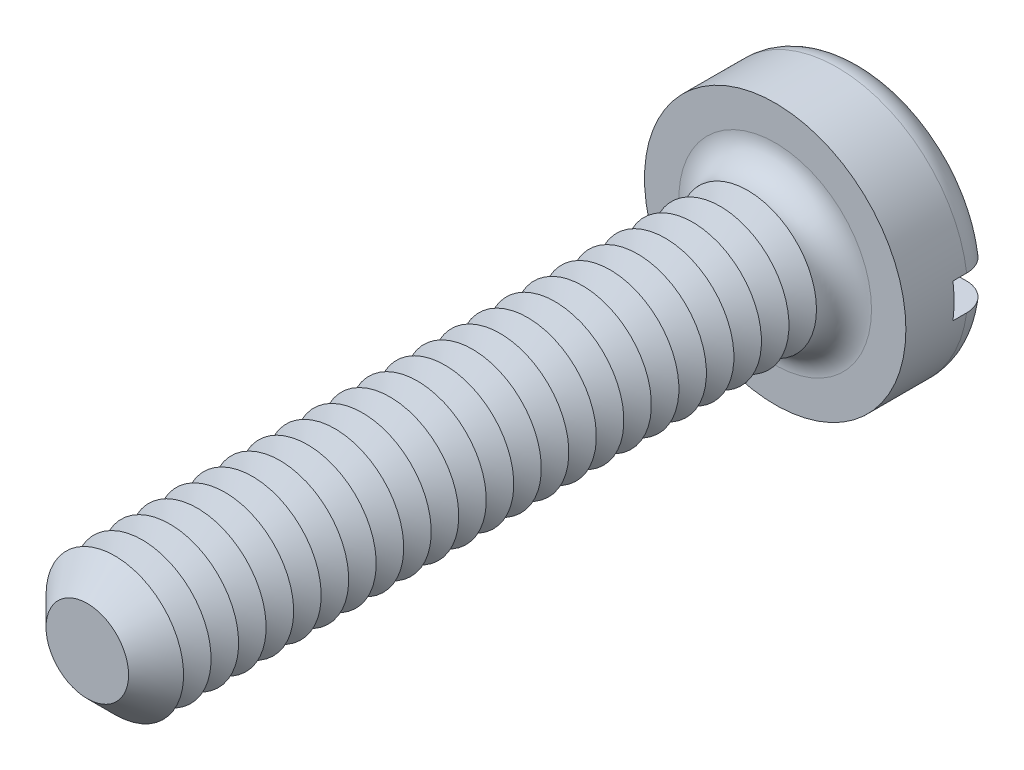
SolidWorks part; units mm, degrees
ref_plane "Front Plane" through (0, 0, 0) normal (0, 0, 1) x (1, 0, 0)
ref_plane "Top Plane" through (0, 0, 0) normal (0, 1, 0) x (1, 0, 0)
ref_plane "Right Plane" through (0, 0, 0) normal (1, 0, 0) x (0, 0, -1)
sketch "Sketch3" plane through (0, 0, 0) normal (0, 0, 1) x (1, 0, 0)
  circle A0 centre (0, 0) radius 1.9
  dimension "D1" = 3.8
extrude "Boss-Extrude2" add sketch "Sketch3" against normal blind 1.3
sketch "Sketch4" plane through (0, 0, 0) normal (0, 0, 1) x (1, 0, 0)
  circle A0 centre (0, 0) radius 1
  dimension "D1" = 2
extrude "Boss-Extrude3" add sketch "Sketch4" along normal blind 10
fillet "Fillet1" radius 0.4 2 edges at (1.9, 0, -1.3) (1, 0, 0)
chamfer "Chamfer1" distance 0.4 angle 45 1 edges at (1, 0, 10)
sketch "Sketch5" plane through (0, 0, 0) normal (1, 0, 0) x (0, 0, -1)
  line L0 (1.6944, 0) -> (-7.6738, 0) construction
sketch "Sketch6" plane through (0, 0, 0) normal (1, 0, 0) x (0, 0, -1)
  line L0 (-0.4, 1) -> (-0.6, 0.6536)
  line L1 (-0.6, 0.6536) -> (-0.8, 1)
  line L2 (-0.4, 1) -> (-9.6, 1) construction
  line L3 (-0.8, 1) -> (-0.4, 1)
  dimension "D1" = 0.4
revolve "Cut-Revolve1" cut sketch "Sketch6" angle 360 about L0
pattern_linear "LPattern1" count 23 spacing 0.4 along (0, 0, 1) of "Cut-Revolve1"
sketch "Sketch8" plane through (0, 0, -1.3) normal (0, 0, -1) x (-1, 0, 0)
  line L1 (1.9, -0.25) -> (-1.9, -0.25)
  line L2 (1.9, -0.25) -> (1.9, 0.25)
  line L3 (1.9, 0.25) -> (-1.9, 0.25)
  line L4 (-1.9, -0.25) -> (-1.9, 0.25)
  line L5 (1.9, -0.25) -> (-1.9, 0.25) construction
  line L6 (1.9, 0.25) -> (-1.9, -0.25) construction
  point P0 (0, 0)
  dimension "D1" = 3.8
  dimension "D2" = 0.5
extrude "Cut-Extrude1" cut sketch "Sketch8" against normal blind 0.6
